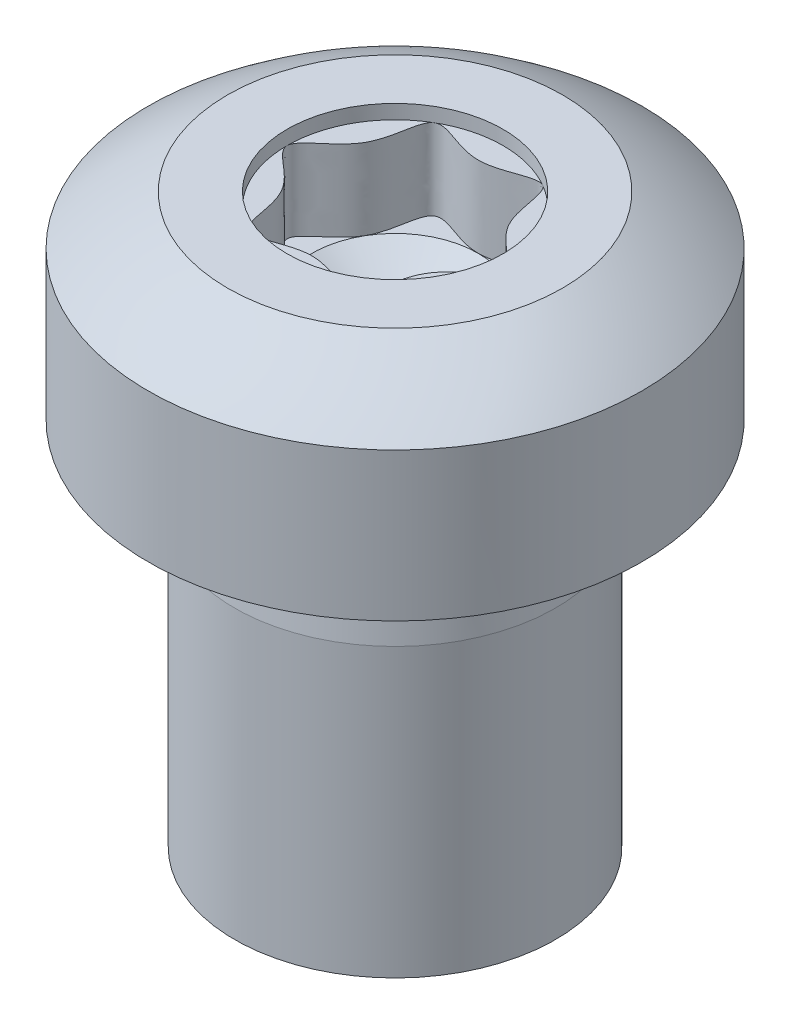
SolidWorks part; units mm, degrees
ref_plane "Front" through (0, 0, 0) normal (0, 0, 1) x (1, 0, 0)
ref_plane "Top" through (0, 0, 0) normal (0, 1, 0) x (1, 0, 0)
ref_plane "Right" through (0, 0, 0) normal (1, 0, 0) x (0, 0, -1)
sketch "Sketch1" plane through (0, 0, 0) normal (0, 0, 1) x (1, 0, 0)
  line L0 (0, 0) -> (0, 34.6184) construction
  line L1 (0, 0) -> (1.3, 0)
  line L2 (1.3, 0) -> (1.3, 3)
  line L3 (1.3, 3) -> (2, 3)
  line L4 (2, 3) -> (2, 4.6)
  line L5 (2, 4.6) -> (0, 4.6)
  line L6 (0, 4.6) -> (0, 0)
  line L7 (2, 3) -> (2.4, 3) construction
  line L8 (2.4, 3) -> (2.4, 0.8) construction
revolve "BODY" add sketch "Sketch1" angle 360 about L0
sketch "Sketch2" plane through (0, 0, 0) normal (0, 0, 1) x (1, 0, 0)
  line L0 (2, 4.2) -> (0, 1.702) construction
  line L3 (2, 3) -> (2, 4.6) construction
  line L4 (0, 0) -> (0, 34.6184) construction
  line L5 (0, 4.902) -> (0, 5.3842)
  line L6 (3.2, 1.702) -> (3.2, 5.3842)
  line L7 (3.2, 5.3842) -> (0, 5.3842)
  line L8 (0, 5.3842) -> (3.2, 5.3842)
  arc A0 (3.2, 1.702) -> (0, 4.902) centre (0, 1.702) ccw
revolve "HEAD-CUT" cut sketch "Sketch2" angle 360 about axis through (0, 0, 0) along (0, 1, 0)
sketch "Sketch4" plane through (0, 0, 0) normal (0, 0, 1) x (1, 0, 0)
  line L0 (-1.3, 2.3264) -> (-1.2436, 2.9)
  line L1 (-1.3, 3) -> (-1.3, 0) construction
  line L2 (-1.3, 3) -> (-1.3, 2.3264)
  arc A0 (-1.2436, 2.9) -> (-1.3, 3) centre (-1.3431, 2.9098) ccw
revolve "GAP" cut sketch "Sketch4" angle 360 about axis through (0, 0, 0) along (0, 1, 0)
sketch "Sketch5" plane through (0, 4.6, 0) normal (0, 1, 0) x (-1, 0, 0)
  line L0 (0, 0.6731) -> (0, 0) construction
  line L1 (0, 0) -> (0.4375, 0.7578) construction
  circle A0 centre (0, 0) radius 0.6731 construction
  circle A1 centre (0, 0) radius 0.875
  spline S0 degree 3 poles (0, 0.5431) (0.5387, 0.933) (0.4704, 0.2716) (1.0773, 0) (0.4704, -0.2716) (0.5387, -0.933) (0, -0.5431) (-0.5387, -0.933) (-0.4704, -0.2716) (-1.0773, 0) (-0.4704, 0.2716) (-0.5387, 0.933) (0, 0.5431) (0.5387, 0.933) (0.4704, 0.2716) knots -0.25 -0.166667 -0.083333 0 0.083333 0.166667 0.25 0.333333 0.416667 0.5 0.583333 0.666667 0.75 0.833333 0.916667 1 1.083333 1.166667 1.25 only from (0.4375, 0.7578) to (0.4375, 0.7578)
  point P4 (0, 0.6731)
  point P5 (0.4375, 0.7578)
  point P9 (0.875, 0)
  point P10 (0.5829, 0.3365)
  point P11 (0.5829, -0.3365)
  point P12 (0, -0.6731)
  point P13 (-0.5829, -0.3365)
  point P14 (-0.5829, 0.3365)
  point P15 (0.4375, -0.7578)
  point P16 (-0.4375, -0.7578)
  point P19 (-0.875, 0)
  point P20 (-0.4375, 0.7578)
extrude "Recess-Cut-Extrude1" cut sketch "Sketch5" against normal blind 0.77
sketch "Sketch3" plane through (0, 0, 0) normal (0, 0, 1) x (1, 0, 0)
  line L0 (0, 3.4414) -> (0.6731, 3.83)
  line L1 (0, 0) -> (0, 34.6184) construction
  line L2 (0.6731, 3.83) -> (0, 3.83)
  line L3 (0, 3.83) -> (0, 3.4414)
revolve "DRILL-CUT" cut sketch "Sketch3" angle 360 about axis through (0, 0, 0) along (0, 1, 0)
sketch "Sketch6" plane through (0, 0, 0) normal (0, 0, 1) x (1, 0, 0)
  line L0 (1.3, 0) -> (1.0835, 0.125)
  line L1 (1.0835, 0.125) -> (1.3, 0.25)
  line L4 (1.3, 0.25) -> (1.3, 0)
  line L5 (0, 0) -> (0, 34.6184) construction
revolve "ThreadSchematic" [suppressed] cut sketch "Sketch6" angle 360 about axis through (0, 0, 0) along (0, 1, 0)
pattern_linear "ThdSchPat" [suppressed] count 6 spacing 0.4 along (0, 1, 0)
sketch "Sketch7" plane through (0, 4.6, 0) normal (0, 1, 0) x (-1, 0, 0)
  circle A0 centre (0, 0) radius 0.875
extrude "Recess-Cut-Extrude2" cut sketch "Sketch7" against normal blind 0.1155
equation "\"D1@Sketch2\" = \"HEAD_HT@Sketch1\" * 0.25"
equation "\"D1@Sketch4\" = \"CONER_RAD@Sketch4\""
equation "\"D1@Recess-Cut-Extrude1\" = \"SLOT_DEP@Sketch3\""
equation "\"D1@Sketch7\" = \"slot_dia@Sketch5\""
equation "\"D1@Recess-Cut-Extrude2\" = \"SLOT_DEP@Sketch3\" * 0.15"
equation "\"D3@Sketch5\" = \"slot_dia@Sketch5\" / 1.3"
equation "\"DRILL_RAD@Sketch3\" = \"D3@Sketch5\" * 0.5"
equation "\"D1@ThreadCosmetic\" = \"thread_length@Sketch1\""
equation "\"D2@ThreadCosmetic\" = \"DIA@Sketch1\" - 1.0825 * \"pitch@Sketch1\""
equation "\"D1@Sketch6\" = \"D2@ThreadCosmetic\" / 2"
equation "\"D3@ThdSchPat\" = \"pitch@Sketch1\""
equation "\"D1@ThdSchPat\" = \"thread_length@Sketch1\" / \"pitch@Sketch1\""
